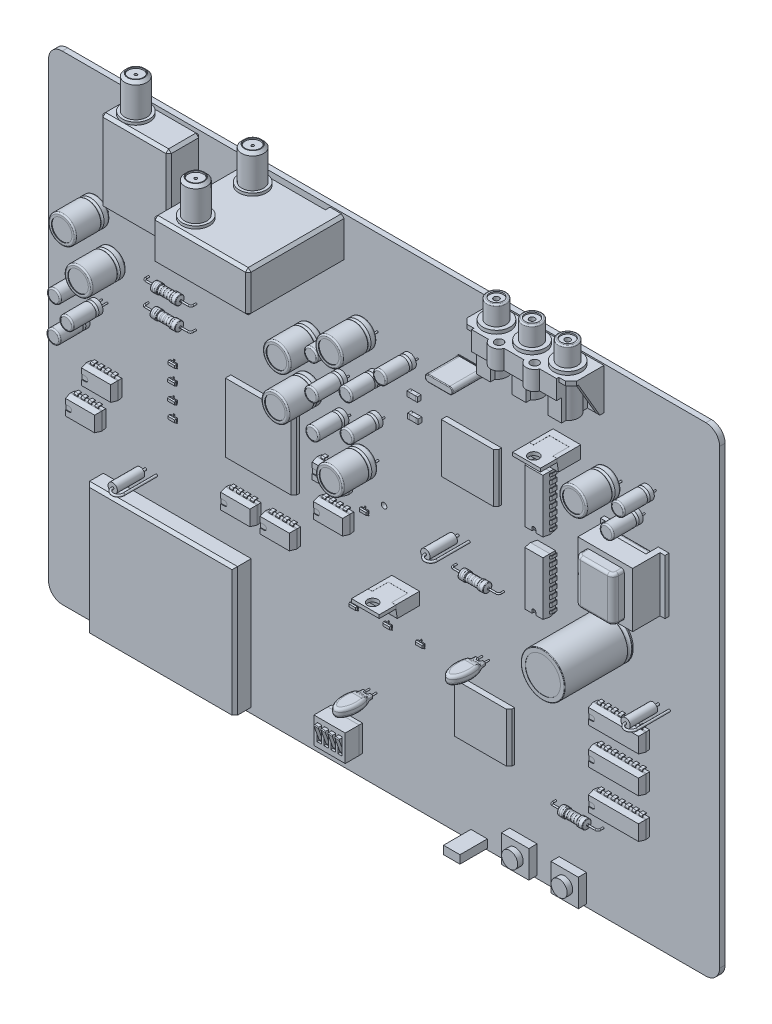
SolidWorks part; units mm, degrees
ref_plane "Front Plane" through (0, 0, 0) normal (0, 0, 1) x (1, 0, 0)
ref_plane "Top Plane" through (0, 0, 0) normal (0, 1, 0) x (1, 0, 0)
ref_plane "Right Plane" through (0, 0, 0) normal (1, 0, 0) x (0, 0, -1)
imported_body "PC Board"
sketch "Sketch1" plane through (0, 0, 0) normal (0, 0, -1) x (-1, 0, 0)
  circle A1 centre (0, 2.5) radius 1
extrude "Cut-Extrude1" cut sketch "Sketch1" against normal up to next
